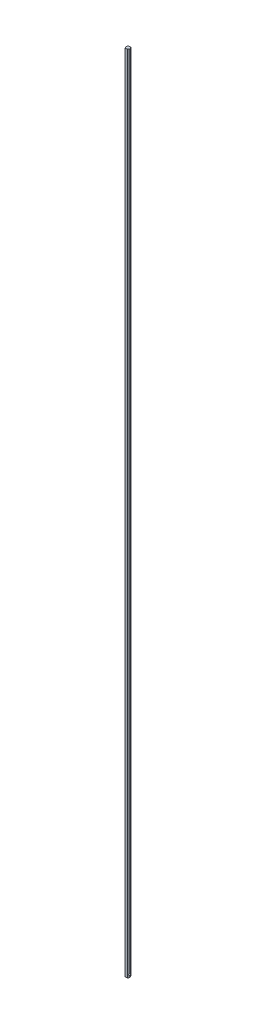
SolidWorks part; units mm, degrees
ref_plane "Front Plane" through (0, 0, 0) normal (0, 0, 1) x (1, 0, 0)
ref_plane "Top Plane" through (0, 0, 0) normal (0, 1, 0) x (1, 0, 0)
ref_plane "Right Plane" through (0, 0, 0) normal (1, 0, 0) x (0, 0, -1)
sketch "Sketch1" plane through (0, 0, 0) normal (0, 1, 0) x (1, 0, 0)
  line L1 (11.547, 0) -> (5.7735, 10)
  line L2 (5.7735, 10) -> (-5.7735, 10)
  line L3 (-5.7735, 10) -> (-11.547, 0)
  line L4 (-11.547, 0) -> (-5.7735, -10)
  line L5 (-5.7735, -10) -> (5.7735, -10)
  line L6 (5.7735, -10) -> (11.547, 0)
  circle A0 centre (0, 0) radius 10 construction
extrude "Boss-Extrude1" add sketch "Sketch1" along normal blind 4550
ref_plane "Plane1" through (-11.547, 0, 0) normal (0, -1, 0) x (-1, 0, 0)
ref_plane "Plane2" through (0, 0, 0) normal (-1, 0, 0) x (0, 0, 1)
sketch "Sketch6" plane through (0, 0, 0) normal (-1, 0, 0) x (0, 0, 1)
  line L0 (0, 0) -> (0, 15) construction
  circle A0 centre (0, 15) radius 5
extrude "Cut-Extrude1" cut sketch "Sketch6" against normal through all both and the other way through all
sketch "Sketch7" plane through (0, 0, 10) normal (0, 0, 1) x (1, 0, 0)
  text T0 "2"
sketch "Sketch8" plane through (0, 0, 10) normal (0, 0, 1) x (1, 0, 0)
  line L0 (-5.7735, 4550) -> (0, 4550) construction
  line L1 (-5.7735, 4550) -> (5.7735, 4550) construction
sketch "Sketch10" plane through (0, 0, 10) normal (0, 0, 1) x (1, 0, 0)
  line L0 (0, 2303.3511) -> (-5.7735, 2303.3511) construction
  line L1 (-5.7735, 4550) -> (-5.7735, 0) construction
  line L2 (0, 2553.3511) -> (0, 2053.3511)
